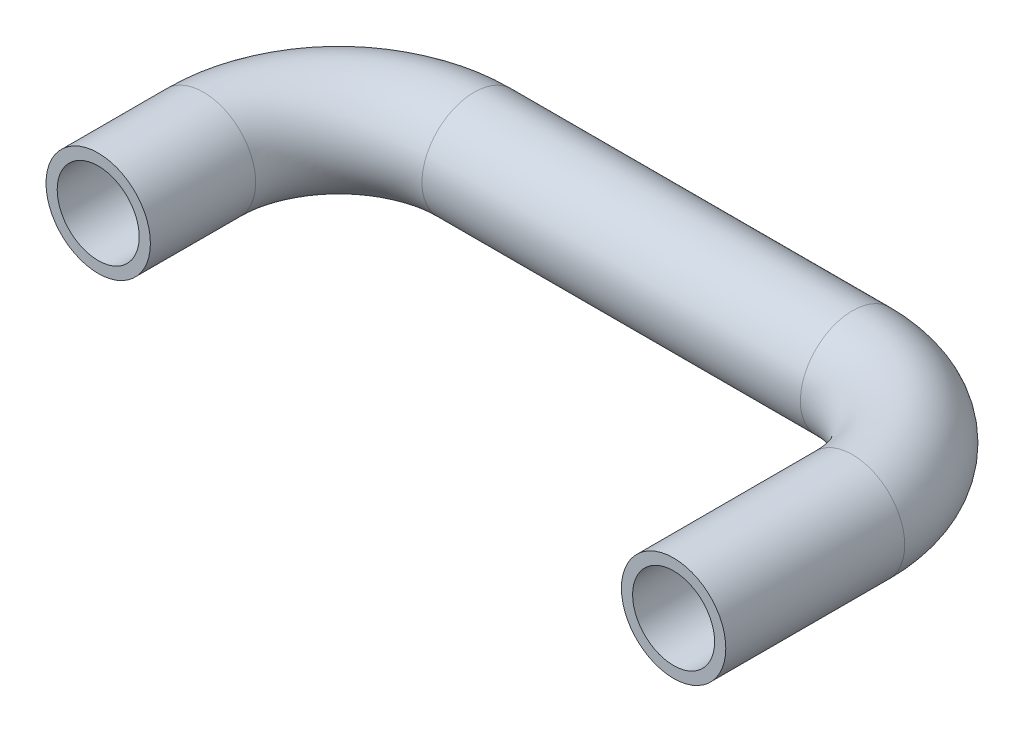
SolidWorks part; units mm, degrees
ref_plane "Front Plane" through (0, 0, 0) normal (0, 0, 1) x (1, 0, 0)
ref_plane "Top Plane" through (0, 0, 0) normal (0, 1, 0) x (1, 0, 0)
ref_plane "Right Plane" through (0, 0, 0) normal (1, 0, 0) x (0, 0, -1)
sketch "Sketch1" plane through (0, 0, 0) normal (0, 1, 0) x (1, 0, 0)
  line L0 (0, 0) -> (0, 28.25)
  line L1 (36.3, 64.55) -> (137.8, 64.55)
  line L2 (171.25, 31.1) -> (171.25, -16.9)
  arc A0 (0, 28.25) -> (36.3, 64.55) centre (36.3, 28.25) cw
  arc A1 (137.8, 64.55) -> (171.25, 31.1) centre (137.8, 31.1) cw
  dimension "D1" = 36.3
  dimension "D2" = 33.45
  dimension "D3" = 101.5
  dimension "D4" = 28.25
  dimension "D5" = 48
sketch "Sketch2" plane through (0, 0, 0) normal (0, 0, 1) x (1, 0, 0)
  circle A0 centre (0, 0) radius 14
  dimension "D1" = 28
sweep "Sweep-Thin1" add profiles "Sketch2" path "Sketch1" parameters "D1"=3
